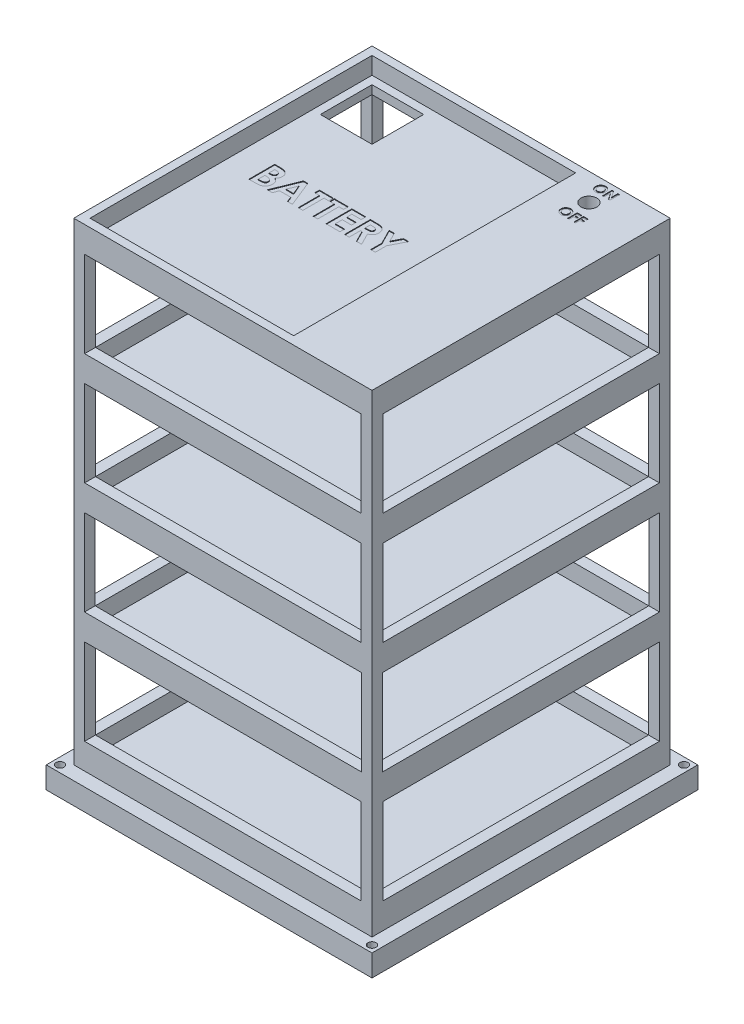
SolidWorks part; units mm, degrees
ref_plane "Front Plane" through (0, 0, 0) normal (0, 0, 1) x (1, 0, 0)
ref_plane "Top Plane" through (0, 0, 0) normal (0, 1, 0) x (1, 0, 0)
ref_plane "Right Plane" through (0, 0, 0) normal (1, 0, 0) x (0, 0, -1)
sketch "Sketch1" plane through (0, 0, 0) normal (0, 1, 0) x (1, 0, 0)
  line L1 (-55, -55) -> (55, -55)
  line L2 (-55, -55) -> (-55, 55)
  line L3 (-55, 55) -> (55, 55)
  line L4 (55, -55) -> (55, 55)
  line L5 (-55, -55) -> (55, 55) construction
  line L6 (-55, 55) -> (55, -55) construction
  point P0 (0, 0)
  dimension "D1" = 110
  dimension "D2" = 110
extrude "Boss-Extrude1" add sketch "Sketch1" along normal blind 9.525
sketch "Sketch3" plane through (0, 0, 0) normal (0, -1, 0) x (1, 0, 0)
  line L0 (55, 55) -> (55, -55) construction
  line L1 (-60.08, -60.08) -> (60.08, -60.08)
  line L2 (-60.08, -60.08) -> (-60.08, 60.08)
  line L3 (-60.08, 60.08) -> (60.08, 60.08)
  line L4 (60.08, -60.08) -> (60.08, 60.08)
  line L5 (-60.08, -60.08) -> (60.08, 60.08) construction
  line L6 (-60.08, 60.08) -> (60.08, -60.08) construction
  line L7 (-55, 55) -> (55, 55) construction
  point P0 (0, 0)
  dimension "D1" = 5.08
  dimension "D2" = 5.08
extrude "Boss-Extrude2" add sketch "Sketch3" along normal blind 8
sketch "Sketch4" plane through (0, 0, 0) normal (0, 1, 0) x (1, 0, 0)
  line L0 (-60.08, 60.08) -> (-55, 60.08) construction
  line L1 (-55, 55) -> (-55, 60.08) construction
  line L2 (-60.08, 60.08) -> (60.08, 60.08) construction
  line L3 (0, -5.2388) -> (0, 5.2388) construction
  line L4 (55, 55) -> (55, 60.08) construction
  line L5 (60.08, 60.08) -> (55, 60.08) construction
  line L6 (-5.2388, 0) -> (5.2388, 0) construction
  line L7 (60.08, -60.08) -> (55, -60.08) construction
  line L8 (55, -55) -> (55, -60.08) construction
  line L9 (-55, -55) -> (-55, -60.08) construction
  line L10 (-60.08, -60.08) -> (-55, -60.08) construction
  circle A0 centre (-57.54, 57.54) radius 1.5
  circle A1 centre (57.54, 57.54) radius 1.5
  circle A2 centre (57.54, -57.54) radius 1.5
  circle A3 centre (-57.54, -57.54) radius 1.5
  point P10 (-57.54, 60.08)
  point P11 (-55, 57.54)
  dimension "D1" = 3
extrude "Cut-Extrude2" cut sketch "Sketch4" against normal through all
sketch "Sketch2" plane through (0, 9.525, 0) normal (0, 1, 0) x (1, 0, 0)
  line L1 (-51, -51) -> (51, -51)
  line L2 (-51, -51) -> (-51, 51)
  line L3 (-51, 51) -> (51, 51)
  line L4 (51, -51) -> (51, 51)
  line L5 (-51, -51) -> (51, 51) construction
  line L6 (-51, 51) -> (51, -51) construction
  point P0 (0, 0)
  dimension "D1" = 102
  dimension "D2" = 102
extrude "Cut-Extrude1" cut sketch "Sketch2" against normal blind 6.35
sketch "Sketch5" plane through (0, 9.525, 0) normal (0, 1, 0) x (1, 0, 0)
  line L0 (-5.2388, 0) -> (5.2388, 0) construction
  line L1 (-55, 55) -> (-51, 55)
  line L2 (-55, 55) -> (-55, 51)
  line L3 (-55, 51) -> (-51, 51)
  line L4 (-51, 55) -> (-51, 51)
  line L5 (-55, -51) -> (-51, -51)
  line L6 (-51, -55) -> (-51, -51)
  line L7 (-55, -55) -> (-51, -55)
  line L8 (-55, -55) -> (-55, -51)
  line L9 (0, -5.2388) -> (0, 5.2388) construction
  line L10 (55, -55) -> (55, -51)
  line L11 (55, -55) -> (51, -55)
  line L12 (51, -55) -> (51, -51)
  line L13 (55, -51) -> (51, -51)
  line L14 (55, 51) -> (51, 51)
  line L15 (51, 55) -> (51, 51)
  line L16 (55, 55) -> (51, 55)
  line L17 (55, 55) -> (55, 51)
extrude "Boss-Extrude3" add sketch "Sketch5" along normal blind 31.75
sketch "Sketch6" plane through (0, 41.275, 0) normal (0, 1, 0) x (1, 0, 0)
  line L1 (-55, 55) -> (55, 55)
  line L2 (-55, 55) -> (-55, -55)
  line L3 (-55, -55) -> (55, -55)
  line L4 (55, 55) -> (55, -55)
extrude "Boss-Extrude4" add sketch "Sketch6" along normal blind 9.525
sketch "Sketch7" plane through (0, 50.8, 0) normal (0, 1, 0) x (1, 0, 0)
  line L1 (-51.054, -51.054) -> (51.054, -51.054)
  line L2 (-51.054, -51.054) -> (-51.054, 51.054)
  line L3 (-51.054, 51.054) -> (51.054, 51.054)
  line L4 (51.054, -51.054) -> (51.054, 51.054)
  line L5 (-51.054, -51.054) -> (51.054, 51.054) construction
  line L6 (-51.054, 51.054) -> (51.054, -51.054) construction
  point P0 (0, 0)
  dimension "D1" = 102.108
  dimension "D2" = 102.108
extrude "Cut-Extrude3" cut sketch "Sketch7" against normal blind 6.35
sketch "Sketch8" plane through (0, 50.8, 0) normal (0, 1, 0) x (1, 0, 0)
  line L0 (0, -5.2388) -> (0, 5.2388) construction
  line L1 (-55, 55) -> (-51.054, 55)
  line L2 (-55, 55) -> (-55, 51.054)
  line L3 (-55, 51.054) -> (-51.054, 51.054)
  line L4 (-51.054, 55) -> (-51.054, 51.054)
  line L5 (55, 51.054) -> (51.054, 51.054)
  line L6 (51.054, 55) -> (51.054, 51.054)
  line L7 (55, 55) -> (51.054, 55)
  line L8 (55, 55) -> (55, 51.054)
  line L9 (-5.2388, 0) -> (5.2388, 0) construction
  line L10 (55, -55) -> (55, -51.054)
  line L11 (55, -55) -> (51.054, -55)
  line L12 (51.054, -55) -> (51.054, -51.054)
  line L13 (55, -51.054) -> (51.054, -51.054)
  line L14 (-55, -51.054) -> (-51.054, -51.054)
  line L15 (-51.054, -55) -> (-51.054, -51.054)
  line L16 (-55, -55) -> (-51.054, -55)
  line L17 (-55, -55) -> (-55, -51.054)
extrude "Boss-Extrude5" add sketch "Sketch8" along normal blind 31.75
sketch "Sketch9" plane through (0, 82.55, 0) normal (0, 1, 0) x (1, 0, 0)
  line L1 (-55, 55) -> (55, 55)
  line L2 (-55, 55) -> (-55, -55)
  line L3 (-55, -55) -> (55, -55)
  line L4 (55, 55) -> (55, -55)
extrude "Boss-Extrude6" add sketch "Sketch9" along normal blind 9.525
sketch "Sketch10" plane through (0, 92.075, 0) normal (0, 1, 0) x (1, 0, 0)
  line L1 (-51, -51) -> (51, -51)
  line L2 (-51, -51) -> (-51, 51)
  line L3 (-51, 51) -> (51, 51)
  line L4 (51, -51) -> (51, 51)
  line L5 (-51, -51) -> (51, 51) construction
  line L6 (-51, 51) -> (51, -51) construction
  point P0 (0, 0)
  dimension "D1" = 102
  dimension "D2" = 102
extrude "Cut-Extrude4" cut sketch "Sketch10" against normal blind 6.35
sketch "Sketch11" plane through (0, 92.075, 0) normal (0, 1, 0) x (1, 0, 0)
  line L0 (0, -55.0412) -> (0, 55.0412) construction
  line L1 (-55, 55) -> (-51, 55)
  line L2 (-55, 55) -> (-55, 51)
  line L3 (-55, 51) -> (-51, 51)
  line L4 (-51, 55) -> (-51, 51)
  line L5 (55, 51) -> (51, 51)
  line L6 (51, 55) -> (51, 51)
  line L7 (55, 55) -> (51, 55)
  line L8 (55, 55) -> (55, 51)
  line L9 (-55.0412, 0) -> (55.0412, 0) construction
  line L10 (55, -55) -> (55, -51)
  line L11 (55, -55) -> (51, -55)
  line L12 (51, -55) -> (51, -51)
  line L13 (55, -51) -> (51, -51)
  line L14 (-55, -51) -> (-51, -51)
  line L15 (-51, -55) -> (-51, -51)
  line L16 (-55, -55) -> (-51, -55)
  line L17 (-55, -55) -> (-55, -51)
extrude "Boss-Extrude7" add sketch "Sketch11" along normal blind 31.75
sketch "Sketch12" plane through (0, 123.825, 0) normal (0, 1, 0) x (1, 0, 0)
  line L1 (-55, 55) -> (55, 55)
  line L2 (-55, 55) -> (-55, -55)
  line L3 (-55, -55) -> (55, -55)
  line L4 (55, 55) -> (55, -55)
extrude "Boss-Extrude8" add sketch "Sketch12" along normal blind 9.525
sketch "Sketch13" plane through (0, 133.35, 0) normal (0, 1, 0) x (1, 0, 0)
  line L1 (-51, -51) -> (51, -51)
  line L2 (-51, -51) -> (-51, 51)
  line L3 (-51, 51) -> (51, 51)
  line L4 (51, -51) -> (51, 51)
  line L5 (-51, -51) -> (51, 51) construction
  line L6 (-51, 51) -> (51, -51) construction
  point P0 (0, 0)
  dimension "D1" = 102
  dimension "D2" = 102
extrude "Cut-Extrude5" cut sketch "Sketch13" against normal blind 6.35
sketch "Sketch14" plane through (0, 133.35, 0) normal (0, 1, 0) x (1, 0, 0)
  line L0 (0, -66.088) -> (0, 66.088) construction
  line L1 (-55, 55) -> (-51, 55)
  line L2 (-55, 55) -> (-55, 51)
  line L3 (-55, 51) -> (-51, 51)
  line L4 (-51, 55) -> (-51, 51)
  line L5 (55, 51) -> (51, 51)
  line L6 (51, 55) -> (51, 51)
  line L7 (55, 55) -> (51, 55)
  line L8 (55, 55) -> (55, 51)
  line L9 (-66.088, 0) -> (66.088, 0) construction
  line L10 (55, -55) -> (55, -51)
  line L11 (55, -55) -> (51, -55)
  line L12 (51, -55) -> (51, -51)
  line L13 (55, -51) -> (51, -51)
  line L14 (-55, -51) -> (-51, -51)
  line L15 (-51, -55) -> (-51, -51)
  line L16 (-55, -55) -> (-51, -55)
  line L17 (-55, -55) -> (-55, -51)
extrude "Boss-Extrude9" add sketch "Sketch14" along normal blind 31.75
sketch "Sketch15" plane through (0, 165.1, 0) normal (0, 1, 0) x (1, 0, 0)
  line L1 (-55, 55) -> (55, 55)
  line L2 (-55, 55) -> (-55, -55)
  line L3 (-55, -55) -> (55, -55)
  line L4 (55, 55) -> (55, -55)
extrude "Boss-Extrude10" add sketch "Sketch15" along normal blind 9.525
sketch "Sketch16" plane through (0, 174.625, 0) normal (0, 1, 0) x (1, 0, 0)
  line L0 (-55, 55) -> (-55, -55) construction
  line L1 (-52, 52) -> (23.1, 52)
  line L2 (-52, 52) -> (-52, -52)
  line L3 (-52, -52) -> (23.1, -52)
  line L4 (23.1, 52) -> (23.1, -52)
  line L5 (-55, -55) -> (55, -55) construction
  line L6 (55, 55) -> (-55, 55) construction
  dimension "D1" = 3
  dimension "D2" = 75.1
  dimension "D3" = 3
  dimension "D4" = 3
extrude "Cut-Extrude6" cut sketch "Sketch16" against normal blind 6.35
sketch "Sketch17" plane through (0, 174.625, 0) normal (0, 1, 0) x (1, 0, 0)
  line L0 (55, 55) -> (-55, 55) construction
  line L1 (-55, 55) -> (-55, -55) construction
  circle A0 centre (35, 45) radius 2.9
  dimension "D1" = 5.8
  dimension "D2" = 10
  dimension "D3" = 90
extrude "Cut-Extrude7" cut sketch "Sketch17" against normal blind 6.35
sketch "Sketch19" plane through (0, 168.275, 0) normal (0, 1, 0) x (1, 0, 0)
  line L0 (23.1, 52) -> (-52, 52) construction
  line L1 (-49, 49) -> (-29.95, 49)
  line L2 (-49, 49) -> (-49, 29.95)
  line L3 (-49, 29.95) -> (-29.95, 29.95)
  line L4 (-29.95, 49) -> (-29.95, 29.95)
  line L5 (-52, 52) -> (-52, -52) construction
  dimension "D1" = 3
  dimension "D2" = 3
  dimension "D3" = 19.05
  dimension "D4" = 19.05
extrude "Cut-Extrude8" cut sketch "Sketch19" against normal up to next
sketch "Sketch20" plane through (0, 174.625, 0) normal (0, 1, 0) x (1, 0, 0)
  text T0 "<b>ON</b>"
extrude "Cut-Extrude9" cut sketch "Sketch20" against normal blind 0.25
sketch "Sketch22" plane through (0, 174.625, 0) normal (0, 1, 0) x (1, 0, 0)
  text T0 "<b>OFF</b>  "
extrude "Cut-Extrude11" cut sketch "Sketch22" against normal blind 0.25
sketch "Sketch23" plane through (0, 168.275, 0) normal (0, 1, 0) x (1, 0, 0)
  text T0 "<b>BATTERY</b>" font "Century Gothic" height in points 36
extrude "Cut-Extrude12" cut sketch "Sketch23" against normal blind 0.25
